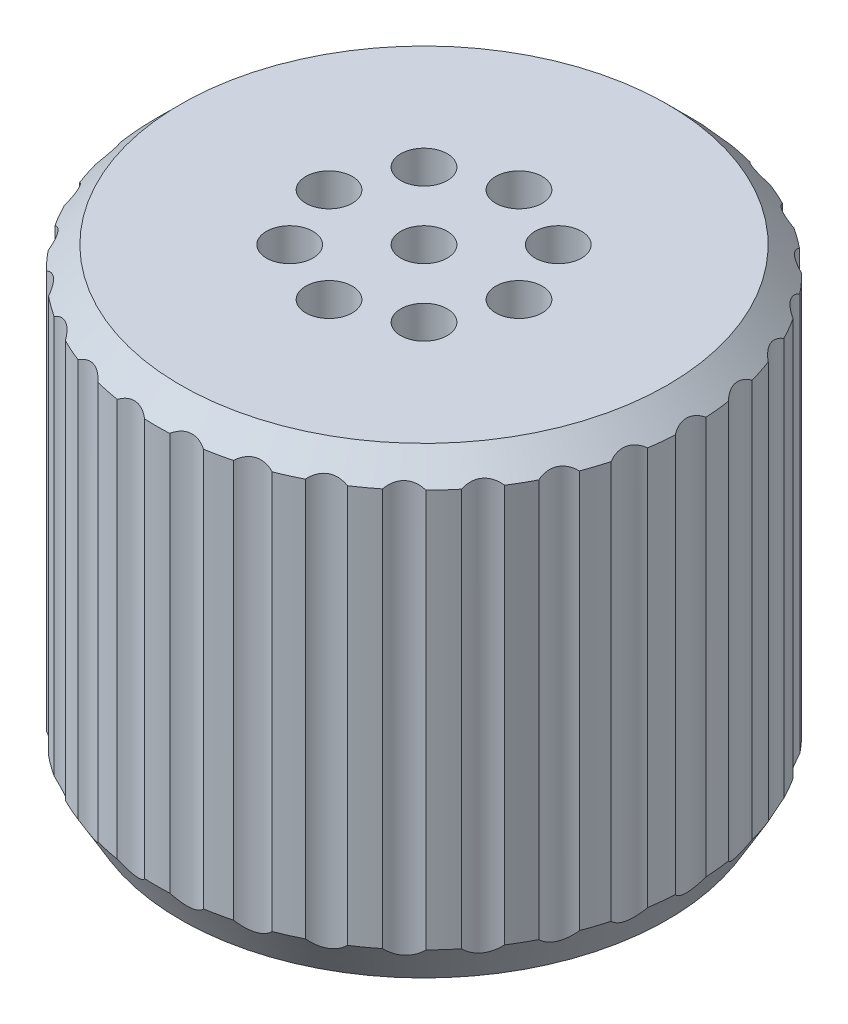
SolidWorks part; units mm, degrees
ref_plane "Front" through (0, 0, 0) normal (0, 0, 1) x (1, 0, 0)
ref_plane "Top" through (0, 0, 0) normal (0, 1, 0) x (1, 0, 0)
ref_plane "Right" through (0, 0, 0) normal (1, 0, 0) x (0, 0, -1)
sketch "Sketch1" plane through (0, 0, 0) normal (0, 0, 1) x (1, 0, 0)
  line L0 (0, 47.0011) -> (0, 0) construction
  line L1 (0, 0) -> (0, 24.765)
  line L2 (0, 24.765) -> (14.2875, 24.765)
  line L3 (14.2875, 24.765) -> (14.2875, 0)
  line L6 (11.6713, 21.59) -> (2.54, 21.59)
  line L7 (2.54, 21.59) -> (2.54, 0)
  line L8 (2.54, 0) -> (0, 0)
  line L12 (12.9413, 0) -> (14.2875, 0)
  line L18 (11.6713, 21.59) -> (11.6713, 1.27)
  line L19 (11.6713, 1.27) -> (12.9413, 0)
  line L20 (3.81, 21.59) -> (3.81, 15.24) construction
  line L21 (3.81, 15.24) -> (2.54, 15.24) construction
  dimension "D1" = 5.08
  dimension "D2" = 21.59
  dimension "D3" = 23.3426
  dimension "D4" = 1.27
  dimension "D5" = 28.575
  dimension "D6" = 45
  dimension "D7" = 3.175
  dimension "D8" = 21.59
  dimension "D9" = 24.765
  dimension "D10" = 6.35
  dimension "D11" = 7.62
  dimension "D12" = 15.24
revolve "Revolve1" add sketch "Sketch1" angle 360 about L0
thread "Thread2" pitch 2.1167 start angle 0, offset 2.54, length 0, pitch 2.1167, diameter 23.3426
ref_plane "Plane2" through (11.6713, -2.54, 0) normal (0, 0, 1) x (1, 0, 0)
sketch "Thread Profile2" plane through (11.6713, -2.54, 0) normal (0, 0, 1) x (1, 0, 0)
  line L0 (0, 0) -> (0, 2.1167) construction
  line L1 (0, 0) -> (1.1457, 0.6615)
  line L2 (1.1457, 0.6615) -> (1.1457, 0.926)
  line L3 (1.1457, 0.926) -> (0, 1.5875)
  line L4 (1.1457, 0.7937) -> (0, 0.7937) construction
  line L11 (0, 0) -> (0, 1.5875)
  point P2 (0, 0)
  dimension "Pitch" = 2.1167
  dimension "Profile_Angle" = 60
  dimension "Profile_Land" = 0.2646
  dimension "Profile_Height" = 1.1457
fillet "Fillet1" radius 0.254 1 edges at (-2.54, 0, 0)
chamfer "Chamfer1" distance 1.27 angle 45 1 edges at (-14.2875, 24.765, 0)
chamfer "Chamfer2" distance 1.27 angle 60 1 edges at (-14.2875, 0, 0)
sketch "Sketch8" plane through (0, 24.765, 0) normal (0, 1, 0) x (1, 0, 0)
  line L1 (15.621, 0) -> (14.2875, 0) construction
  line L2 (14.2875, 0) -> (14.0335, 0) construction
  circle A0 centre (15.621, 0) radius 1.5875
  dimension "D1" = 3.175
  dimension "D3" = 0.254
extrude "Cut-Extrude1" cut sketch "Sketch8" against normal through all
pattern_circular "CirPattern1" count 30 over 360 about axis through (0, 0, 0) along (0, 1, 0) of "Cut-Extrude1"
sketch "Sketch10" plane through (0, 0, 0) normal (0, -1, 0) x (-1, 0, 0)
  point P0 (0, 0)
hole_wizard "#40 (0.098) Diameter Hole1" positions "Sketch10" profile "Sketch11" hole size "#40" standard "ANSI Inch"
sketch "Sketch11" plane through (0, 0, 0) normal (1, 0, 0) x (0, 0, -1)
  line L0 (0, 0) -> (0, 24.765)
  line L1 (0, 24.765) -> (1.2446, 24.765)
  line L2 (1.2446, 24.765) -> (1.2446, 0)
  line L5 (1.2446, 0) -> (0, 0)
  line L11 (0, -6.35) -> (0, 107.95) construction
  dimension "Thru Hole Dia." = 2.4892
  dimension "Thru Hole Depth" = 24.765
sketch "Sketch12" plane through (0, 21.59, 0) normal (0, -1, 0) x (-1, 0, 0)
  point P0 (0, 5.08)
  dimension "D1" = 5.08
hole_wizard "#40 (0.098) Diameter Hole2" positions "Sketch12" profile "Sketch13" hole size "#40" standard "ANSI Inch"
sketch "Sketch13" plane through (0, 21.59, -5.08) normal (1, 0, 0) x (0, 0, -1)
  line L0 (0, 0) -> (0, 3.175)
  line L1 (0, 3.175) -> (1.2446, 3.175)
  line L2 (1.2446, 3.175) -> (1.2446, 0)
  line L5 (1.2446, 0) -> (0, 0)
  line L11 (0, -6.35) -> (0, 107.95) construction
  dimension "Thru Hole Dia." = 2.4892
  dimension "Thru Hole Depth" = 3.175
pattern_circular "CirPattern2" count 8 over 360 about axis through (0, 0, 0) along (0, 1, 0) of "#40 (0.098) Diameter Hole2"
sketch "Sketch14" plane through (0, 0, 0) normal (0, 0, 1) x (1, 0, 0)
  line L0 (2.54, 21.59) -> (2.54, 0) construction
  line L1 (11.6713, 21.59) -> (2.54, 21.59) construction
  line L2 (3.81, 21.59) -> (3.81, 15.24) construction
  line L3 (3.81, 15.24) -> (2.54, 15.24) construction
  line L4 (2.54, 21.59) -> (2.54, 15.24)
  line L5 (3.81, 21.59) -> (2.54, 21.59)
  line L6 (3.81, 21.59) -> (3.81, 15.24)
  line L7 (3.81, 15.24) -> (2.54, 15.24)
revolve "Revolve2" add sketch "Sketch14" angle 360 about L0
